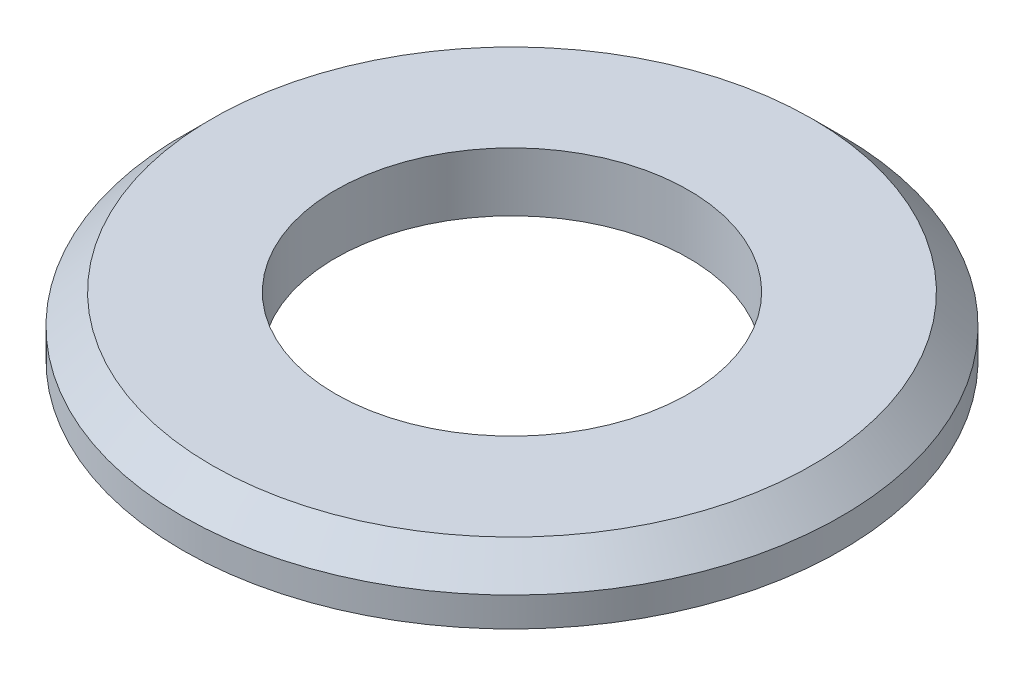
SolidWorks part; units mm, degrees
ref_plane "Front" through (0, 0, 0) normal (0, 0, 1) x (1, 0, 0)
ref_plane "Top" through (0, 0, 0) normal (0, 1, 0) x (1, 0, 0)
ref_plane "Right" through (0, 0, 0) normal (1, 0, 0) x (0, 0, -1)
sketch "Sketch1" plane through (0, 0, 0) normal (0, 1, 0) x (1, 0, 0)
  circle A0 centre (0, 0) radius 7.5
  circle A1 centre (0, 0) radius 14
extrude "Extrude1" add sketch "Sketch1" along normal blind 2.5
chamfer "Chamfer1" distance 1.25 1 edges at (0, 2.5, 14)
